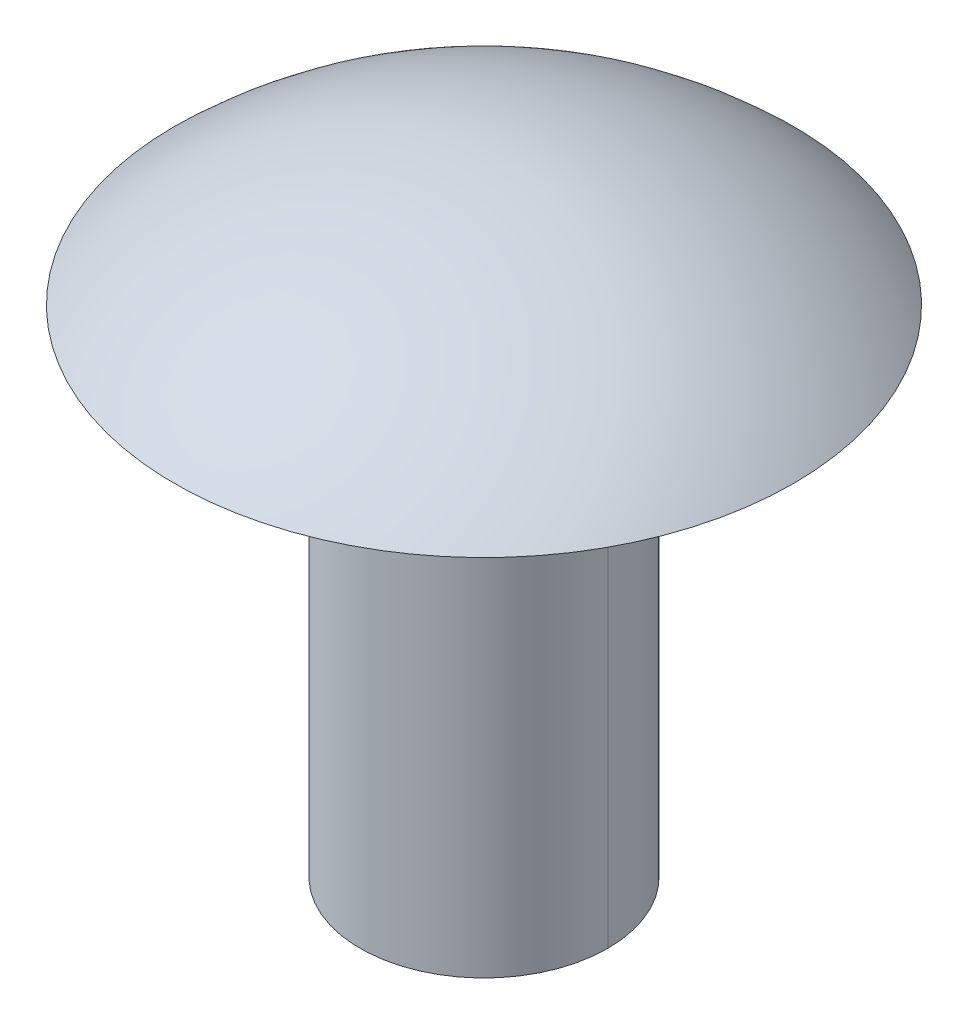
SolidWorks part; units mm, degrees
ref_plane "Front Plane" through (0, 0, 0) normal (0, 0, 1) x (1, 0, 0)
ref_plane "Top Plane" through (0, 0, 0) normal (0, 1, 0) x (1, 0, 0)
ref_plane "Right Plane" through (0, 0, 0) normal (1, 0, 0) x (0, 0, -1)
sketch "Sketch1" plane through (0, 0, 0) normal (0, 1, 0) x (1, 0, 0)
  circle A0 centre (0, 0) radius 4.7625
  dimension "D1" = 9.525
extrude "Boss-Extrude1" add sketch "Sketch1" against normal blind 19.05
sketch "head diameter" plane through (0, 0, 0) normal (0, 1, 0) x (1, 0, 0)
  circle A0 centre (0, 0) radius 11.8999
  circle A1 centre (0, 0) radius 4.7625 construction
  point P4 (11.8999, 0)
  dimension "D1" = 23.7998
sketch "Sketch3" plane through (0, 0, 0) normal (0, 0, 1) x (1, 0, 0)
  line L0 (0, 4.7498) -> (-9.5218, 4.7498) construction
  line L1 (0, 4.7498) -> (0, 0)
  line L2 (0, 0) -> (11.8999, 0)
  arc A0 (0, 4.7498) -> (11.8999, 0) centre (0, -12.5318) cw
  dimension "D2" = 17.2816
  dimension "D1" = 4.7498
  dimension "D3" = 11.8999
revolve "Revolve1" add sketch "Sketch3" angle 360 about L1
sketch "Sketch5" plane through (0, 0, 0) normal (0, 1, 0) x (1, 0, 0)
  line L0 (-11.8999, 0) -> (11.8999, 0)
  circle A0 centre (0, 0) radius 11.8999 construction
